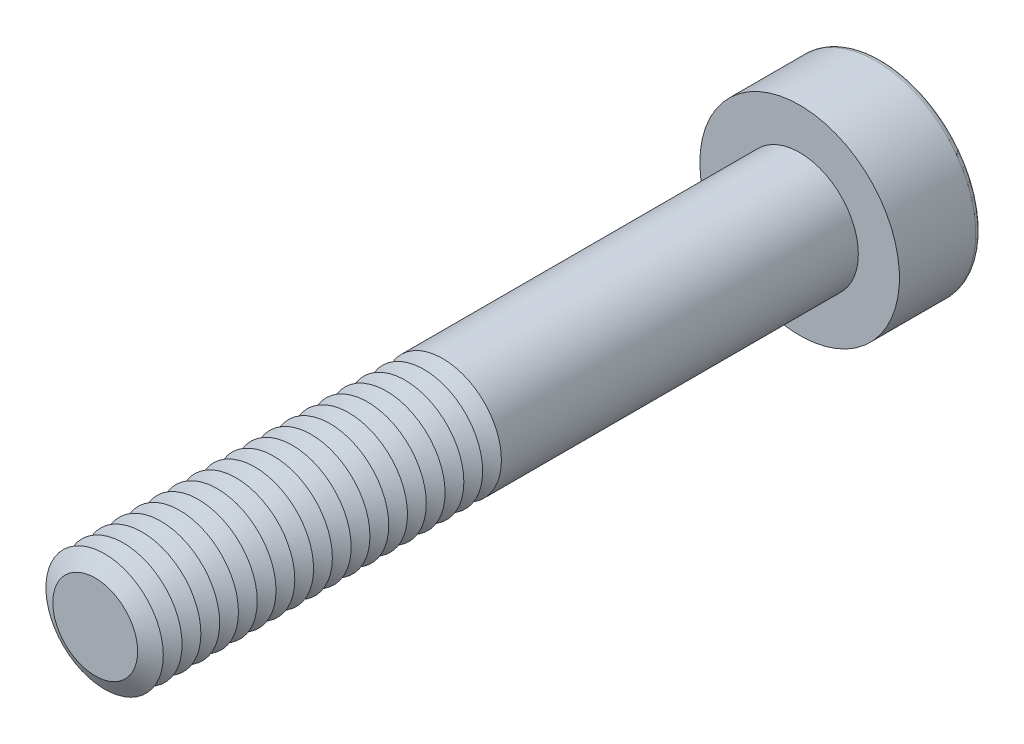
SolidWorks part; units mm, degrees
ref_plane "Front Plane" through (0, 0, 0) normal (0, 0, 1) x (1, 0, 0)
ref_plane "Top Plane" through (0, 0, 0) normal (0, 1, 0) x (1, 0, 0)
ref_plane "Right Plane" through (0, 0, 0) normal (1, 0, 0) x (0, 0, -1)
sketch "Sketch1" plane through (0, 0, 0) normal (0, 0, 1) x (1, 0, 0)
  circle A0 centre (0, 0) radius 2.5
  dimension "D1" = 5
extrude "Boss-Extrude1" add sketch "Sketch1" along normal blind 30
sketch "Sketch2" plane through (0, 0, 0) normal (0, 0, -1) x (-1, 0, 0)
  circle A0 centre (0, 0) radius 4.25
  dimension "D1" = 8.5
extrude "Boss-Extrude2" add sketch "Sketch2" along normal blind 3.5
sketch "Sketch3" plane through (0, 0, -3.5) normal (0, 0, -1) x (-1, 0, 0)
  line L1 (-0.866, 1.5) -> (-1.7321, 0)
  line L2 (-1.7321, 0) -> (-0.866, -1.5)
  line L3 (-0.866, -1.5) -> (0.866, -1.5)
  line L4 (0.866, -1.5) -> (1.7321, 0)
  line L5 (1.7321, 0) -> (0.866, 1.5)
  line L6 (0.866, 1.5) -> (-0.866, 1.5)
  circle A0 centre (0, 0) radius 1.5 construction
  dimension "D1" = 3
extrude "Cut-Extrude1" cut sketch "Sketch3" against normal blind 2.25
fillet "Fillet1" radius 0.25 1 edges at (-4.25, 0, -3.5)
sketch "Sketch4" plane through (0, 0, -1.25) normal (0, 0, -1) x (-1, 0, 0)
  line L0 (0.866, -1.5) -> (1.7321, 0) construction
  circle A0 centre (0, 0) radius 1.5
extrude "Cut-Extrude2" cut sketch "Sketch4" against normal through all draft 60
sketch "Sketch5" plane through (0, 0, -3.5) normal (0, 0, -1) x (-1, 0, 0)
  circle A0 centre (0, 0) radius 1.7321
extrude "Cut-Extrude3" cut sketch "Sketch5" against normal through all draft 75
sketch "Sketch7" plane through (0, 0, 0) normal (1, 0, 0) x (0, 0, -1)
  line L25 (-30, 1.8072) -> (-29.6, 2.5)
  line L26 (-30, 2.5) -> (-30, -2.5) construction
  line L27 (-29.6, 2.5) -> (-30.4, 2.5)
  line L28 (-30.4, 2.5) -> (-30, 1.8072)
  line L29 (0, 2.5) -> (-30, 2.5) construction
  dimension "D1" = 0.8
revolve "Cut-Revolve1" cut sketch "Sketch7" angle 360 about axis through (0, 0, 30) along (0, 0, -1)
pattern_linear "LPattern1" count 19 spacing 0.8 along (0, 0, -1) of "Cut-Revolve1"
